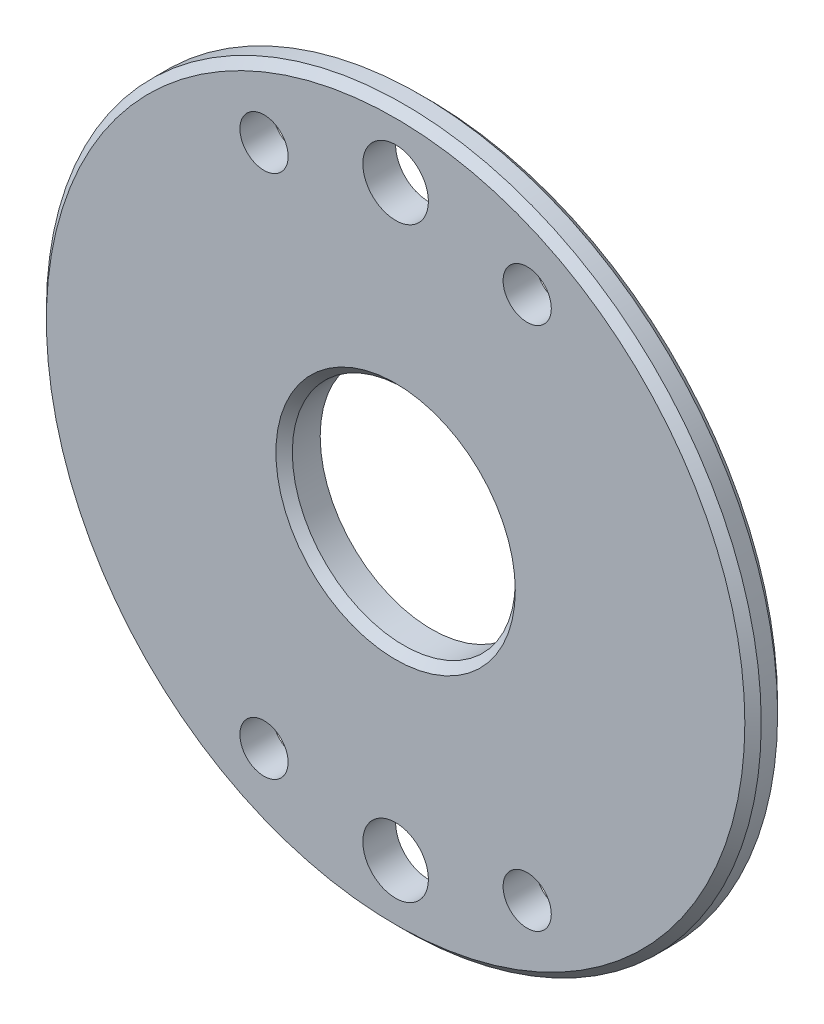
SolidWorks part; units mm, degrees
ref_plane "Front Plane" through (0, 0, 0) normal (0, 0, 1) x (1, 0, 0)
ref_plane "Top Plane" through (0, 0, 0) normal (0, 1, 0) x (1, 0, 0)
ref_plane "Right Plane" through (0, 0, 0) normal (1, 0, 0) x (0, 0, -1)
sketch "Sketch1" plane through (0, 0, 0) normal (0, 0, 1) x (1, 0, 0)
  circle A0 centre (0, 89.5) radius 10 construction
  circle A1 centre (0, -89.5) radius 10 construction
  circle A2 centre (0, 0) radius 109 construction
  circle A3 centre (0, 89.5) radius 10
  circle A4 centre (0, -89.5) radius 10
  circle A5 centre (0, 0) radius 109
  circle A7 centre (0, 0) radius 33
  circle A8 centre (0, 0) radius 34
  circle A17 centre (-40.1279, -80) radius 6.35 construction
  circle A18 centre (40.1279, -80) radius 6.35 construction
  circle A19 centre (40.1279, 80) radius 6.35 construction
  circle A20 centre (-40.1279, 80) radius 6.35 construction
  circle A21 centre (-40.1279, -80) radius 6.35
  circle A22 centre (40.1279, -80) radius 6.35
  circle A23 centre (40.1279, 80) radius 6.35
  circle A24 centre (-40.1279, 80) radius 6.35
  circle A25 centre (-40.1279, 80) radius 7.35
  circle A26 centre (40.1279, 80) radius 7.35
  circle A27 centre (40.1279, -80) radius 7.35
  circle A28 centre (-40.1279, -80) radius 7.35
  circle A29 centre (0, 0) radius 33 construction
  dimension "D1" = 1
  dimension "D2" = 1
extrude "Boss-Extrude1" add sketch "Sketch1" along normal blind 10 contours A5 A8 A3 A4
chamfer "Chamfer1" distance 2.5 angle 45 1 edges at (34, 0, 10)
chamfer "Chamfer2" distance 2.5 angle 45 2 edges at (109, 0, 0) (109, 0, 10)
sketch "Sketch2" plane through (0, 0, 0) normal (0, 0, -1) x (-1, 0, 0)
  circle A0 centre (0, 0) radius 75 construction
  circle A1 centre (0, 0) radius 75
  circle A2 centre (0, 0) radius 34 construction
  circle A3 centre (0, 0) radius 34
extrude "Boss-Extrude2" add sketch "Sketch2" along normal blind 1
